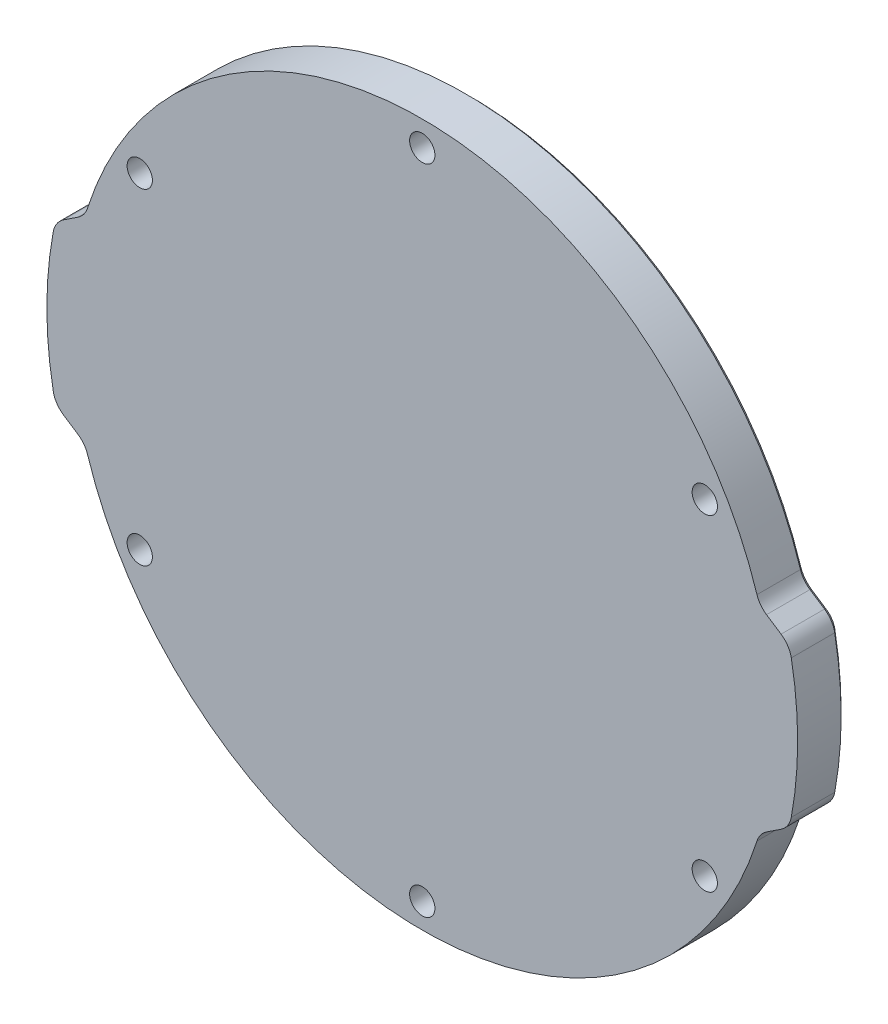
SolidWorks part; units mm, degrees
other "<WTE3-M-END-CAP-R1>-<Chamfer1>"
ref_plane "Front Plane" through (0, 0, 0) normal (0, 0, 1) x (1, 0, 0)
ref_plane "Top Plane" through (0, 0, 0) normal (0, 1, 0) x (1, 0, 0)
ref_plane "Right Plane" through (0, 0, 0) normal (1, 0, 0) x (0, 0, -1)
inserted part "WTE3-M-END-CAP-R1"
